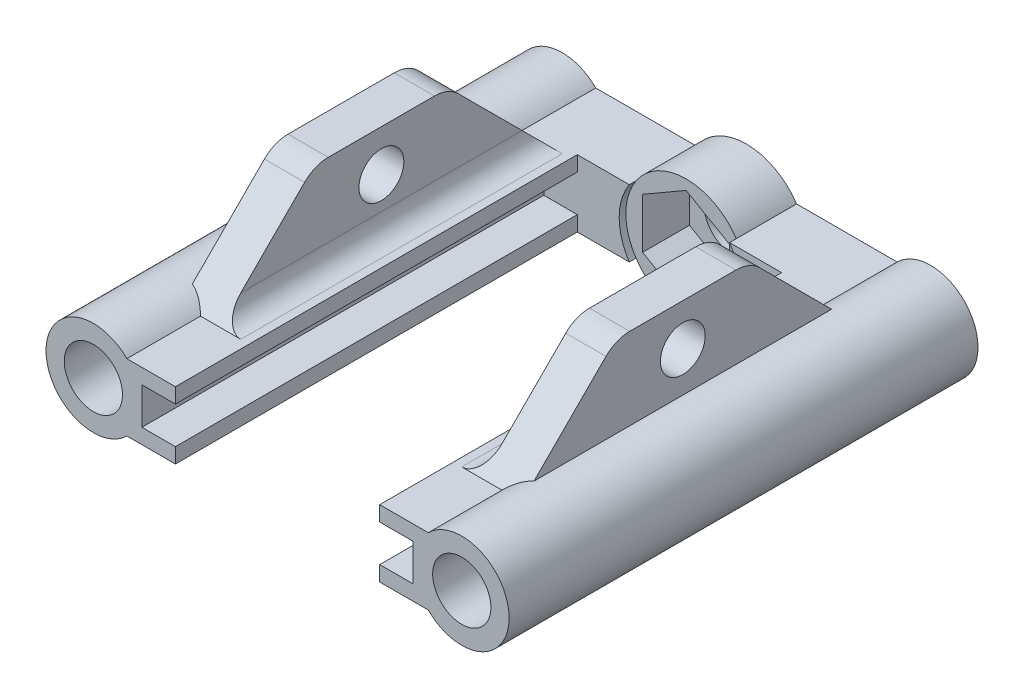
SolidWorks part; units mm, degrees
ref_plane "Front Plane" through (0, 0, 0) normal (0, 0, 1) x (1, 0, 0)
ref_plane "Top Plane" through (0, 0, 0) normal (0, 1, 0) x (1, 0, 0)
ref_plane "Right Plane" through (0, 0, 0) normal (1, 0, 0) x (0, 0, -1)
sketch "Sketch1" plane through (0, 0, 0) normal (0, 0, 1) x (1, 0, 0)
  line L1 (-22.5, -5) -> (22.5, -5)
  line L2 (-22.5, -5) -> (-22.5, 5)
  line L3 (-22.5, 5) -> (22.5, 5)
  line L4 (22.5, -5) -> (22.5, 5)
  line L5 (-22.5, -5) -> (22.5, 5) construction
  line L6 (-22.5, 5) -> (22.5, -5) construction
  point P0 (0, 0)
  dimension "D1" = 10
  dimension "D2" = 45
extrude "Boss-Extrude1" add sketch "Sketch1" along normal blind 10
sketch "Sketch2" plane through (0, 0, 10) normal (0, 0, 1) x (1, 0, 0)
  line L0 (-31.3164, 0) -> (33.7901, 0) construction
  line L1 (-15.25, 5) -> (-15.25, 2.75)
  line L2 (22.5, 5) -> (-22.5, 5) construction
  line L3 (-15.25, 2.75) -> (-20.25, 2.75)
  line L4 (-20.25, 2.75) -> (-20.25, -2.75)
  line L5 (-20.25, -2.75) -> (-15.25, -2.75)
  line L6 (-15.25, -2.75) -> (-15.25, -5)
  line L7 (-22.5, -5) -> (22.5, -5) construction
  line L8 (-15.25, -5) -> (-22.5, -5)
  line L9 (-22.5, -5) -> (-22.5, 5)
  line L10 (-22.5, 5) -> (-15.25, 5)
  line L11 (0, 20.5989) -> (0, -20.1421) construction
  line L12 (20.25, -2.75) -> (15.25, -2.75)
  line L13 (15.25, -2.75) -> (15.25, -5)
  line L14 (15.25, -5) -> (22.5, -5)
  line L15 (22.5, -5) -> (22.5, 5)
  line L16 (22.5, 5) -> (15.25, 5)
  line L17 (15.25, 5) -> (15.25, 2.75)
  line L18 (15.25, 2.75) -> (20.25, 2.75)
  line L19 (20.25, 2.75) -> (20.25, -2.75)
  dimension "D1" = 40.5
  dimension "D2" = 5.5
  dimension "D3" = 5
extrude "Boss-Extrude2" add sketch "Sketch2" along normal blind 60
sketch "Sketch3" plane through (0, 0, 0) normal (0, 0, 1) x (1, 0, 0)
  circle A0 centre (0, 0) radius 9
  dimension "D1" = 18
extrude "Boss-Extrude3" add sketch "Sketch3" along normal up to surface (10 mm away)
sketch "Sketch4" plane through (0, 0, 10) normal (0, 0, 1) x (1, 0, 0)
  line L0 (0, 0) -> (0, 16.174) construction
  line L1 (6.5, 3.7528) -> (0, 7.5056)
  line L2 (0, 7.5056) -> (-6.5, 3.7528)
  line L3 (-6.5, 3.7528) -> (-6.5, -3.7528)
  line L4 (-6.5, -3.7528) -> (0, -7.5056)
  line L5 (0, -7.5056) -> (6.5, -3.7528)
  line L6 (6.5, -3.7528) -> (6.5, 3.7528)
  circle A0 centre (0, 0) radius 6.5 construction
  dimension "D1" = 13
extrude "Cut-Extrude1" cut sketch "Sketch4" against normal blind 8
sketch "Sketch5" plane through (0, 0, 2) normal (0, 0, 1) x (1, 0, 0)
  circle A0 centre (0, 0) radius 4.35
  dimension "D1" = 8.7
extrude "Cut-Extrude2" cut sketch "Sketch5" against normal up to next
sketch "Sketch6" plane through (0, 0, 10) normal (0, 0, 1) x (1, 0, 0)
  circle A0 centre (0, 0) radius 9
extrude "Cut-Extrude3" cut sketch "Sketch6" against normal blind 1
sketch "Sketch7" plane through (0, 0, 0) normal (0, 0, 1) x (1, 0, 0)
  line L0 (-36.0841, 0) -> (34.4188, 0) construction
  line L1 (0, 26.9537) -> (0, -24.3288) construction
  line L2 (-22.5, 5) -> (-22.5, -5)
  line L3 (22.5, 5) -> (22.5, -5)
  arc A0 (-22.5, 5) -> (-22.5, -5) centre (-27.5, 0) ccw
  circle A1 centre (-27.5, 0) radius 4.35
  circle A2 centre (27.5, 0) radius 4.35
  arc A3 (22.5, 5) -> (22.5, -5) centre (27.5, 0) cw
  dimension "D1" = 8.7
  dimension "D2" = 55
extrude "Boss-Extrude4" add sketch "Sketch7" along normal up to surface (70 mm away)
sketch "Sketch8" plane through (0, 5, 0) normal (0, 1, 0) x (1, 0, 0)
  line L0 (0, 0) -> (0, -73.2265) construction
  line L1 (-34.5711, -35) -> (43.0692, -35) construction
  line L2 (-34.5711, 0) -> (-34.5711, -70) construction
  line L3 (22.5, -70) -> (22.5, 0) construction
  line L4 (19.5, -45) -> (25.5, -45)
  line L5 (19.5, -45) -> (19.5, -25)
  line L6 (19.5, -25) -> (25.5, -25)
  line L7 (25.5, -45) -> (25.5, -25)
  line L8 (19.5, -45) -> (25.5, -25) construction
  line L9 (19.5, -25) -> (25.5, -45) construction
  line L10 (-19.5, -45) -> (-25.5, -45)
  line L11 (-25.5, -45) -> (-25.5, -25)
  line L12 (-19.5, -25) -> (-25.5, -25)
  line L13 (-19.5, -45) -> (-19.5, -25)
  point P7 (22.5, -35)
  dimension "D1" = 6
  dimension "D2" = 20
extrude "Boss-Extrude5" add sketch "Sketch8" along normal blind 14
sketch "Sketch9" plane through (-25.5, 0, 0) normal (-1, 0, 0) x (0, 0, 1)
  line L0 (35, 19) -> (35, -13.2105) construction
  line L1 (25, 19) -> (45, 19) construction
  circle A0 centre (35, 12.8) radius 3.35
  dimension "D1" = 6.7
  dimension "D2" = 6.2
extrude "Cut-Extrude4" cut sketch "Sketch9" against normal through all
chamfer "Chamfer1" distance 14 angle 45 4 edges at (-21, 5, 45) (-21, 5, 25) (21, 5, 25) (21, 5, 45)
fillet "Fillet1" radius 5 4 edges at (22.5, 19, 45) (22.5, 19, 25) (-22.5, 19, 25) (-22.5, 19, 45)
fillet "Fillet2" radius 3 2 edges at (-19.5, 5, 35) (19.5, 5, 35)
